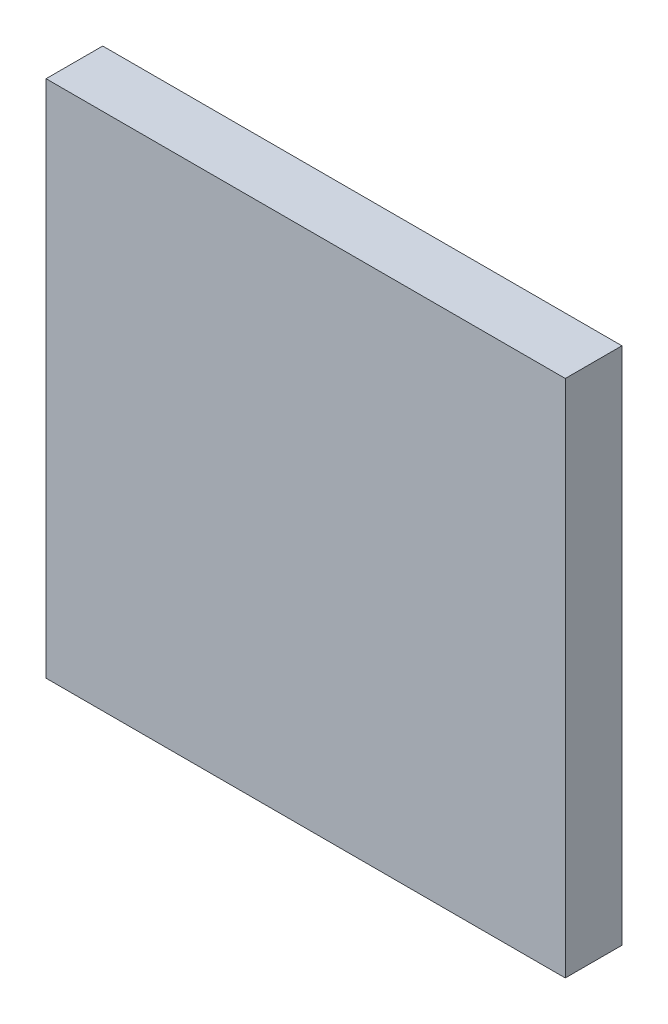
SolidWorks part; units mm, degrees
ref_plane "Face" through (0, 0, 0) normal (0, 0, 1) x (1, 0, 0)
ref_plane "Dessus" through (0, 0, 0) normal (0, 1, 0) x (1, 0, 0)
ref_plane "Droite" through (0, 0, 0) normal (1, 0, 0) x (0, 0, -1)
sketch "Esquisse1" plane through (0, 0, 0) normal (0, 0, 1) x (1, 0, 0)
  line L1 (0, 0) -> (110, 0)
  line L2 (0, 0) -> (0, 110)
  line L3 (0, 110) -> (110, 110)
  line L4 (110, 0) -> (110, 110)
  dimension "D1" = 110
extrude "Base-Extrusion" add sketch "Esquisse1" along normal blind 12
